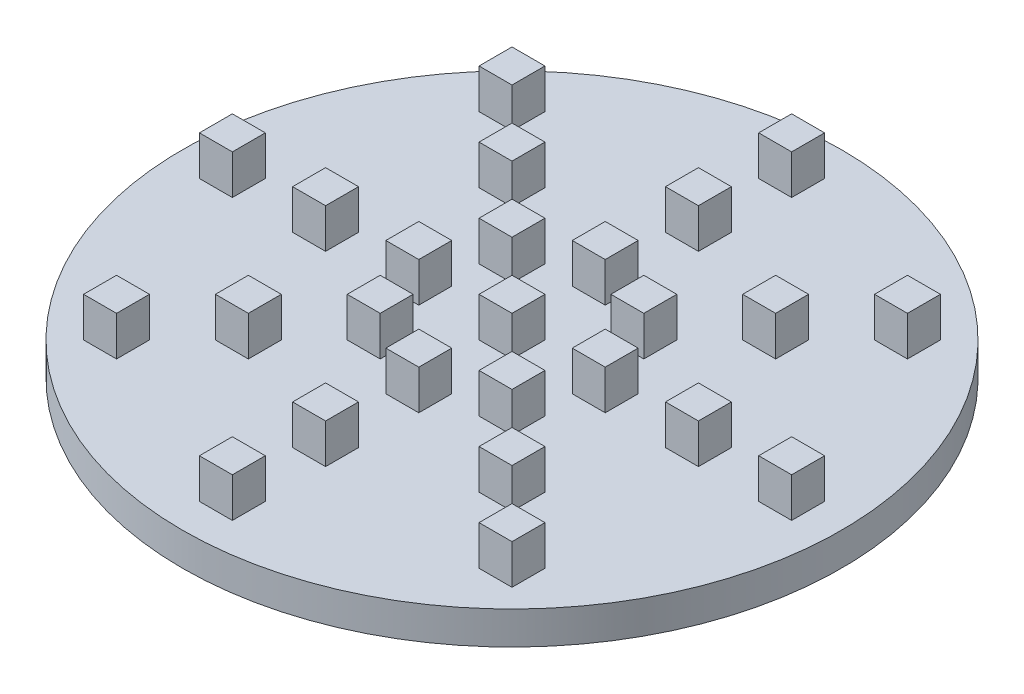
SolidWorks part; units mm, degrees
ref_plane "Front Plane" through (0, 0, 0) normal (0, 0, 1) x (1, 0, 0)
ref_plane "Top Plane" through (0, 0, 0) normal (0, 1, 0) x (1, 0, 0)
ref_plane "Right Plane" through (0, 0, 0) normal (1, 0, 0) x (0, 0, -1)
sketch "Sketch1" plane through (0, 0, 0) normal (0, 1, 0) x (1, 0, 0)
  circle A0 centre (0, 0) radius 127
  dimension "D1" = 254
extrude "Extrude1" add sketch "Sketch1" along normal blind 12.7
sketch "Sketch2" plane through (0, 12.7, 0) normal (0, 1, 0) x (1, 0, 0)
  line L1 (-6.35, 6.35) -> (6.35, 6.35)
  line L2 (-6.35, 6.35) -> (-6.35, -6.35)
  line L3 (-6.35, -6.35) -> (6.35, -6.35)
  line L4 (6.35, 6.35) -> (6.35, -6.35)
  dimension "D1" = 12.7
  dimension "D2" = 12.7
  dimension "D3" = 6.35
  dimension "D4" = 6.35
extrude "Extrude2" add sketch "Sketch2" along normal blind 15.24
other "Fill Pattern4" parameters "D4"=35.921, "D6"=8, "D3"=0
other "Fill Pattern1" parameters "D1"=22.7185, "D2"=60, "D3"=0
